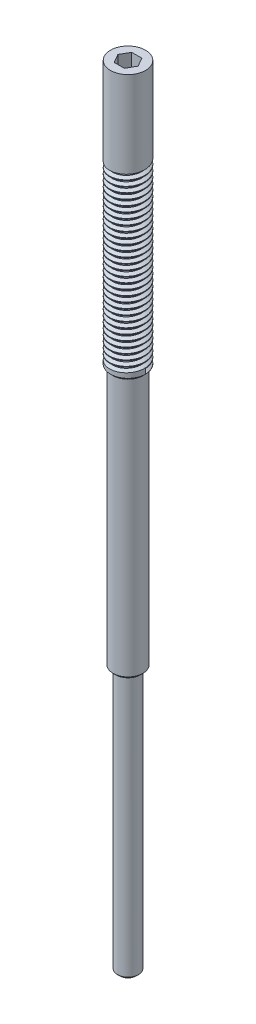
SolidWorks part; units mm, degrees
ref_plane "前视基准面" through (0, 0, 0) normal (0, 0, 1) x (1, 0, 0)
ref_plane "上视基准面" through (0, 0, 0) normal (0, 1, 0) x (1, 0, 0)
ref_plane "右视基准面" through (0, 0, 0) normal (1, 0, 0) x (0, 0, -1)
other "Configuration Table"
sketch "草图1" plane through (0, 0, 0) normal (0, 0, 1) x (1, 0, 0)
  line L0 (0, 0) -> (-1.2, 0)
  line L1 (-1.2, 0) -> (-1.2, 30)
  line L2 (-1.2, 30) -> (-1.7, 30)
  line L3 (-1.7, 30) -> (-1.7, 60)
  line L4 (-1.7, 60) -> (-2, 60)
  line L5 (-2, 60) -> (-2, 90)
  line L6 (-2, 90) -> (0, 90)
  line L7 (0, 0) -> (0, 7.7962) construction
  line L8 (0, 0) -> (0, 90)
  dimension "D1" = 1.2
  dimension "D2" = 1.7
  dimension "D3" = 2
  dimension "D4" = 30
  dimension "D5" = 30
  dimension "D6" = 30
revolve "旋转1" add sketch "草图1" angle 360 about L7
thread "螺纹线1" pitch 0.635 start angle 0, offset 0, length 20, pitch 0.635, diameter 4
ref_plane "基准面1" through (2, 60, 0) normal (0, 0, 1) x (1, 0, 0)
sketch "螺纹线轮廓1" plane through (2, 60, 0) normal (0, 0, 1) x (1, 0, 0)
  line L0 (0, 0) -> (0, 0.635) construction
  line L11 (0, 0) -> (0, 0.5556)
  line L12 (0, 0.5556) -> (-0.3437, 0.3572)
  line L13 (-0.3437, 0.3572) -> (-0.3437, 0.1984)
  line L15 (-0.3437, 0.1984) -> (0, 0)
  line L17 (-0.3437, 0.2778) -> (0, 0.2778) construction
  point P2 (0, 0)
  dimension "Pitch" = 0.635
  dimension "Profile_Angle" = 60
  dimension "Profile_Land" = 0.1588
  dimension "Profile_Height" = 0.3437
chamfer "倒角1" distance 0.3 angle 45 3 edges at (0, 60, -1.7) (0, 30, -1.7) (0, 0, -1.2)
sketch "草图5" plane through (0, 90, 0) normal (0, 1, 0) x (1, 0, 0)
  line L1 (0.5774, 1) -> (-0.5774, 1)
  line L2 (-0.5774, 1) -> (-1.1547, 0)
  line L3 (-1.1547, 0) -> (-0.5774, -1)
  line L4 (-0.5774, -1) -> (0.5774, -1)
  line L5 (0.5774, -1) -> (1.1547, 0)
  line L6 (1.1547, 0) -> (0.5774, 1)
  circle A0 centre (0, 0) radius 1 construction
  dimension "D1" = 2
extrude "切除-拉伸1" cut sketch "草图5" against normal blind 4
